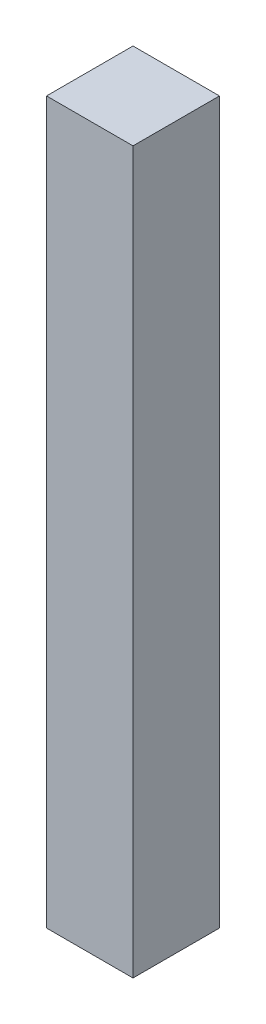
SolidWorks part; units mm, degrees
ref_plane "Plan de face" through (0, 0, 0) normal (0, 0, 1) x (1, 0, 0)
ref_plane "Plan de dessus" through (0, 0, 0) normal (0, 1, 0) x (1, 0, 0)
ref_plane "Plan de droite" through (0, 0, 0) normal (1, 0, 0) x (0, 0, -1)
sketch "Esquisse1" plane through (0, 0, 0) normal (0, 1, 0) x (1, 0, 0)
  line L1 (-120, 120) -> (120, 120)
  line L2 (-120, 120) -> (-120, -120)
  line L3 (-120, -120) -> (120, -120)
  line L4 (120, 120) -> (120, -120)
  line L5 (-120, 120) -> (120, -120) construction
  line L6 (-120, -120) -> (120, 120) construction
  point P0 (0, 0)
  dimension "D1" = 240
extrude "Boss.-Extru.1" add sketch "Esquisse1" along normal blind 2000
